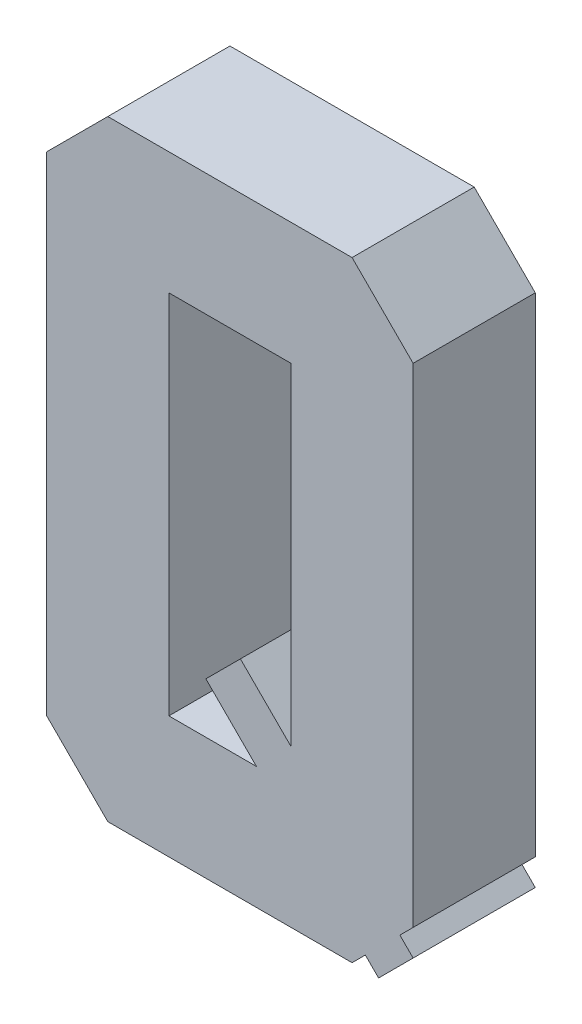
SolidWorks part; units mm, degrees
ref_plane "Plan de face" through (0, 0, 0) normal (0, 0, 1) x (1, 0, 0)
ref_plane "Plan de dessus" through (0, 0, 0) normal (0, 1, 0) x (1, 0, 0)
ref_plane "Plan de droite" through (0, 0, 0) normal (1, 0, 0) x (0, 0, -1)
sketch "Esquisse1" plane through (0, 0, 0) normal (0, 0, 1) x (1, 0, 0)
  line L1 (0, 0) -> (30, 0)
  line L2 (0, 0) -> (0, 50)
  line L3 (0, 50) -> (30, 50)
  line L4 (30, 0) -> (30, 50)
  line L5 (10, 40) -> (20, 40)
  line L6 (10, 40) -> (10, 10)
  line L7 (10, 10) -> (20, 10)
  line L8 (20, 40) -> (20, 10)
  dimension "D1" = 50
  dimension "D2" = 30
  dimension "D3" = 10
  dimension "D4" = 10
  dimension "D5" = 10
  dimension "D6" = 10
extrude "Boss.-Extru.1" add sketch "Esquisse1" along normal blind 10
chamfer "Chanfrein1" distance 5 angle 45 4 edges at (0, 0, 5) (30, 0, 5) (30, 50, 5) (0, 50, 5)
sketch "Esquisse2" plane through (0, 0, 10) normal (0, 0, 1) x (1, 0, 0)
  line L0 (27.1716, 0) -> (30, 2.8284)
  line L2 (27.1716, 0) -> (13.0294, 14.1421)
  line L3 (30, 2.8284) -> (15.8579, 16.9706)
  line L4 (13.0294, 14.1421) -> (15.8579, 16.9706)
  line L5 (5, 0) -> (25, 0) construction
  line L6 (0, 5) -> (5, 0) construction
  dimension "D1" = 4
  dimension "D2" = 2
  dimension "D3" = 20
extrude "Boss.-Extru.2" add sketch "Esquisse2" against normal blind 10
